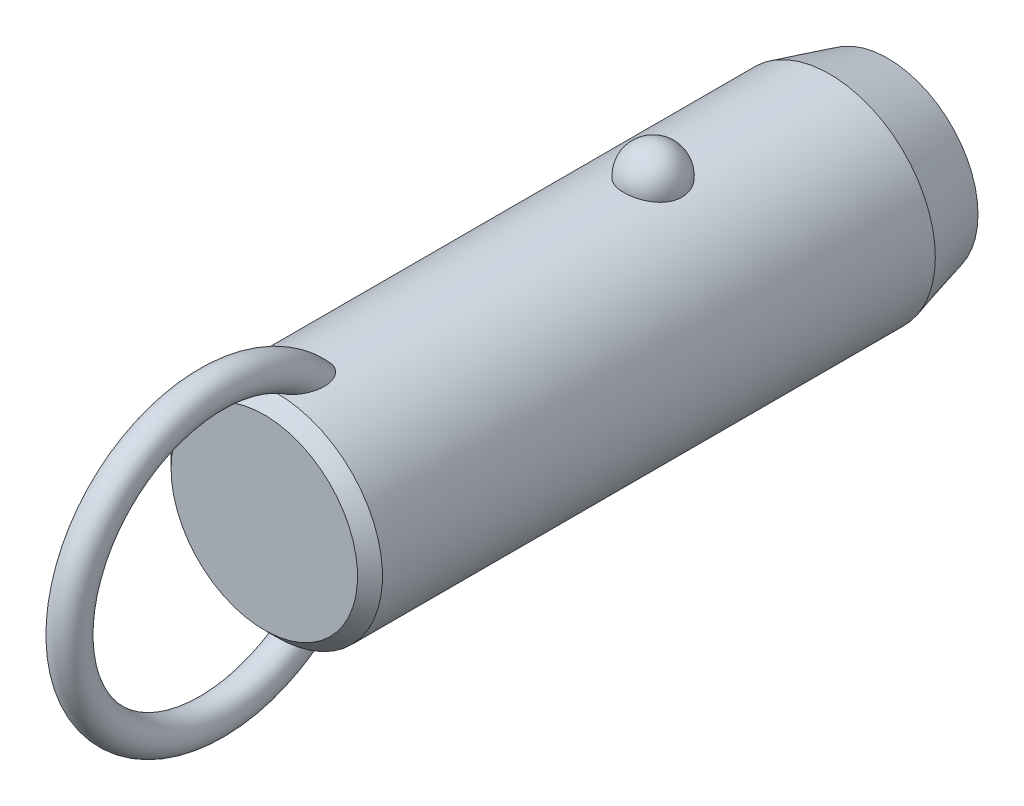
SolidWorks part; units mm, degrees
ref_plane "Front Plane" through (0, 0, 0) normal (0, 0, 1) x (1, 0, 0)
ref_plane "Top Plane" through (0, 0, 0) normal (0, 1, 0) x (1, 0, 0)
ref_plane "Right Plane" through (0, 0, 0) normal (1, 0, 0) x (0, 0, -1)
sketch "Sketch2" plane through (0, 0, 0) normal (0, 0, 1) x (1, 0, 0)
  circle A0 centre (0, 0) radius 12.7
  point P3 (0, 12.7)
  dimension "D1" = 25.4
extrude "Boss-Extrude1" add sketch "Sketch2" along normal blind 30.5
sketch "Sketch3" plane through (0, 0, 0) normal (0, 0, -1) x (-1, 0, 0)
  circle A0 centre (0, 0) radius 12.7
  dimension "D1" = 25.4
extrude "Boss-Extrude2" add sketch "Sketch3" along normal blind 31.7
chamfer "Chamfer1" distance 7 angle 15 1 edges at (-12.7, 0, -31.7)
sketch "Sketch12" plane through (0, 0, 0) normal (1, 0, 0) x (0, 0, -1)
  line L0 (-30.5, 12.7) -> (-30.5, -12.7) construction
  point P0 (-30.5, 0)
sketch "Sketch13" plane through (0, 0, 0) normal (1, 0, 0) x (0, 0, -1)
  circle A0 centre (-49.55, 0) radius 19.05
  point P2 (-30.5, 0)
  dimension "D1" = 38.1
sketch "Sketch14" plane through (0, 0, 0) normal (0, 1, 0) x (1, 0, 0)
  circle A0 centre (0, -32.5) radius 2
  point P2 (0, -30.5)
  dimension "D1" = 4
sweep "Sweep1" add profiles "Sketch14" path "Sketch13"
sketch "Sketch15" plane through (0, 0, 30.5) normal (0, 0, 1) x (1, 0, 0)
  circle A0 centre (0, 0) radius 12.7
  dimension "D1" = 25.4
extrude "Boss-Extrude3" add sketch "Sketch15" along normal blind 12.7
chamfer "Chamfer2" distance 1.5 angle 45 1 edges at (12.7, 0, 43.2)
sketch "Sketch18" plane through (0, 0, 0) normal (1, 0, 0) x (0, 0, -1)
  line L0 (24.7, 12.7) -> (-35.351, 12.7) construction
  line L1 (3.5, 16.2) -> (3.5, 9.2)
  line L2 (-35.351, -12.7) -> (24.7, -12.7) construction
  arc A0 (3.5, 16.2) -> (3.5, 9.2) centre (3.5, 12.7) ccw
  point P4 (0, 12.7)
  dimension "D1" = 28.9
revolve "Revolve1" add sketch "Sketch18" angle 360 about L1
